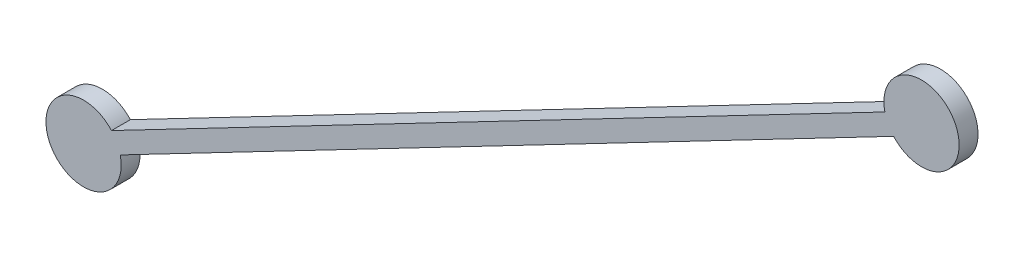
SolidWorks part; units mm, degrees
ref_plane "Plan1" through (0, 0, 0) normal (0, 0, 1) x (1, 0, 0)
ref_plane "Plan2" through (0, 0, 0) normal (0, 1, 0) x (1, 0, 0)
ref_plane "Plan3" through (0, 0, 0) normal (1, 0, 0) x (0, 0, -1)
sketch "Esquisse1" plane through (0, 0, 0) normal (0, 0, 1) x (1, 0, 0)
  line L0 (349.1116, 286.8099) -> (430.9672, 329.4416)
  line L1 (348.1878, 288.5837) -> (430.0434, 331.2155)
  arc A0 (430.9672, 329.4416) -> (430.0434, 331.2155) centre (433.9235, 332.1088) ccw
  arc A1 (348.1878, 288.5837) -> (349.1116, 286.8099) centre (345.2315, 285.9165) ccw
  dimension "D1" = 3.9817
  dimension "D2" = 3.9817
  dimension "D3" = 100
extrude "Base-Extrusion" add sketch "Esquisse1" against normal blind 2
scale "Echelle3"
